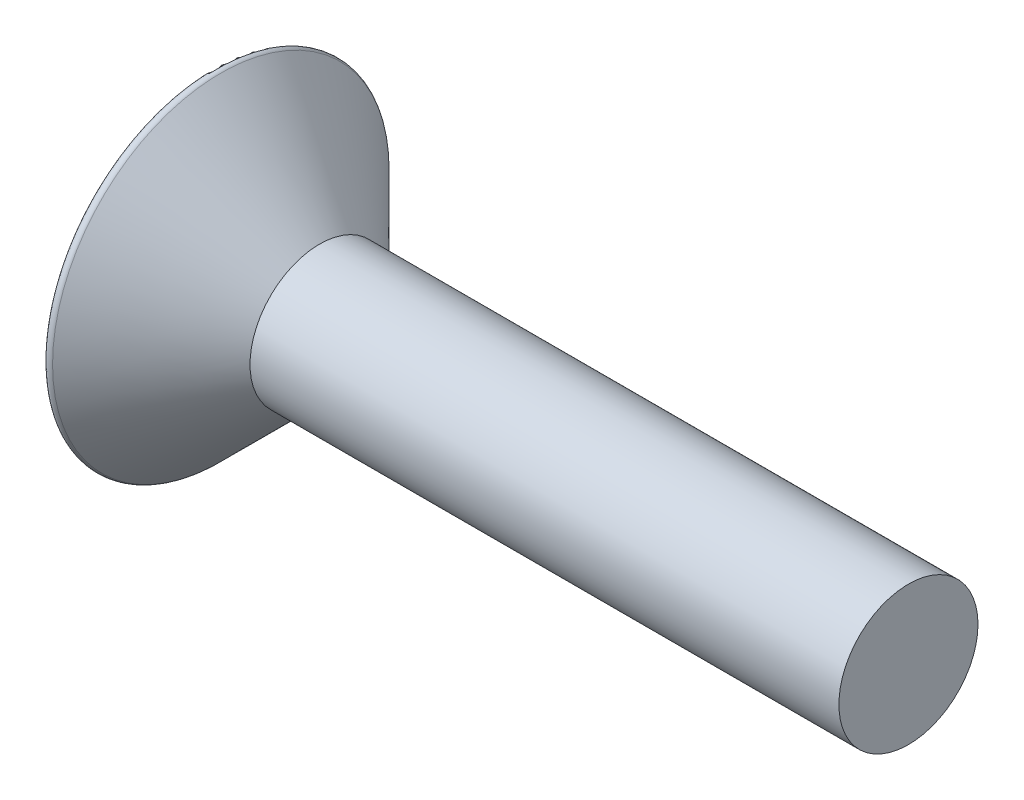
SolidWorks part; units mm, degrees
ref_plane "Front" through (0, 0, 0) normal (0, 0, 1) x (1, 0, 0)
ref_plane "Top" through (0, 0, 0) normal (0, 1, 0) x (1, 0, 0)
ref_plane "Right" through (0, 0, 0) normal (1, 0, 0) x (0, 0, -1)
other "Configuration Table"
ref_plane "Plane1" through (4.6, 0, 0) normal (1, 0, 0) x (0, 0, -1)
sketch "Sketch1" plane through (4.6, 0, 0) normal (1, 0, 0) x (0, 0, -1)
  circle A0 centre (0, 0) radius 3
extrude "BaseHead" add sketch "Sketch1" against normal blind 4.6 draft 45
sketch "Sketch2" plane through (4.6, 0, 0) normal (1, 0, 0) x (0, 0, -1)
  circle A1 centre (0, 0) radius 3
extrude "BaseBody" add sketch "Sketch2" along normal blind 30
sketch "Sketch7" plane through (0, 0, 0) normal (0, 0, 1) x (1, 0, 0)
  line L0 (30, 6) -> (30, -6)
  line L1 (34.6, -3) -> (34.6, 3) construction
  line L2 (34.6, 3) -> (4.6, 3) construction
  line L3 (4.6, -3) -> (34.6, -3) construction
extrude "Cut-Extrude3" cut sketch "Sketch7" against normal through all and the other way through all
sketch "Sketch8" plane through (0, 0, 0) normal (0, 0, 1) x (1, 0, 0)
  line L0 (0, 7.6) -> (4.6, 3)
  line L2 (6.3071, 2.7071) -> (6.6, 3)
  line L3 (6.6, 3) -> (6.6, 7.6)
  line L4 (6.6, 7.6) -> (0, 7.6)
  line L5 (30, 3) -> (4.6, 3) construction
  line L6 (0, 0) -> (8.9995, 0) construction
  line L7 (4.6, 3) -> (4.6, -3) construction
  arc A0 (4.6, 3) -> (6.3071, 2.7071) centre (5.6607, 4.0607) ccw
  dimension "r" = 1.5
  dimension "D1" = 45
  dimension "a" = 2
sketch "Sketch4" plane through (0, 0, 0) normal (1, 0, 0) x (0, 0, -1)
  line L1 (2.396, 0) -> (1.198, 2.075)
  line L2 (1.198, 2.075) -> (-1.198, 2.075)
  line L3 (-1.198, 2.075) -> (-2.396, 0)
  line L4 (-2.396, 0) -> (-1.198, -2.075)
  line L5 (-1.198, -2.075) -> (1.198, -2.075)
  line L6 (1.198, -2.075) -> (2.396, 0)
  circle A0 centre (0, 0) radius 2.075 construction
  dimension "B" = 4.15
extrude "Socket" cut sketch "Sketch4" along normal blind 2
sketch "Sketch5" plane through (2, 0, 0) normal (-1, 0, 0) x (0, 0, 1)
  line L0 (-1.198, 2.075) -> (1.198, 2.075) construction
  line L1 (1.198, 2.075) -> (2.396, 0) construction
  line L2 (2.396, 0) -> (1.198, -2.075) construction
  line L3 (1.198, -2.075) -> (-1.198, -2.075) construction
  line L4 (-2.396, 0) -> (-1.198, 2.075) construction
  line L5 (-1.198, -2.075) -> (-2.396, 0) construction
  line L6 (-1.198, 2.075) -> (1.198, 2.075)
  line L7 (1.198, 2.075) -> (2.396, 0)
  line L8 (2.396, 0) -> (1.198, -2.075)
  line L9 (1.198, -2.075) -> (-1.198, -2.075)
  line L10 (-2.396, 0) -> (-1.198, 2.075)
  line L11 (-1.198, -2.075) -> (-2.396, 0)
extrude "Cut-Extrude2" cut sketch "Sketch5" against normal blind 5 draft 60
sketch "Sketch6" plane through (-30.7487, 13.2487, 0) normal (0, 0, 1) x (0, -1, 0)
  line L0 (13.2487, 89.8637) -> (13.2487, 24.8312) construction
  line L1 (10.6609, 35.7609) -> (10.2487, 35.3487)
  line L2 (-7.1919, 35.3487) -> (-7.1919, 22.7487)
  line L3 (-7.1919, 22.7487) -> (10.2487, 22.7487)
  line L4 (10.7487, 35.973) -> (10.7487, 21.4009)
  line L5 (16.2487, 60.7487) -> (10.2487, 60.7487) construction
  line L6 (10.2487, 22.7487) -> (10.7487, 21.4009)
  line L8 (10.2487, 35.3487) -> (-7.1919, 35.3487)
  arc A0 (10.7487, 35.973) -> (10.6609, 35.7609) centre (10.4487, 35.973) cw
  dimension "D3" = 0.3
  dimension "d1" = 5
  dimension "b" = 38
  dimension "x" = 1.3478
fillet "HeadFillet" radius 0.2 1 edges at (0, 0, -7.6)
sketch "Sketch9" plane through (0, 0, 0) normal (0, 0, 1) x (1, 0, 0)
  line L0 (30, 2.567) -> (30.25, 3)
  line L1 (30.25, 3) -> (30.25, 3.5)
  line L2 (30.25, 3.5) -> (29.75, 3.5)
  line L3 (29.75, 3.5) -> (29.75, 3)
  line L4 (29.75, 3) -> (30, 2.567)
  line L5 (0, 0) -> (36.7555, 0) construction
  line L6 (30, -3) -> (30, 3) construction
revolve "Cut-Revolve10" [suppressed] cut sketch "Sketch9" angle 360 about L5
pattern_linear "LPattern10" [suppressed] count 39 spacing 0.6 along (1, 0, 0)
equation "\"D1@Plane1\" = \"k@BaseHead\""
equation "\"D1@Sketch7\" = \"k@BaseHead\""
equation "\"D1@Sketch9\" = \"d@Sketch2\""
equation "\"D2@Sketch9\" =  ( \"d@Sketch2\" - \"THD_MINOR@ThreadCosmetic1\" )  / 2"
equation "\"D3@LPattern10\" = \"D2@Sketch9\" * 1.2"
equation "\"D1@LPattern10\" = \"bb@ThreadCosmetic1\" / \"D3@LPattern10\" "
